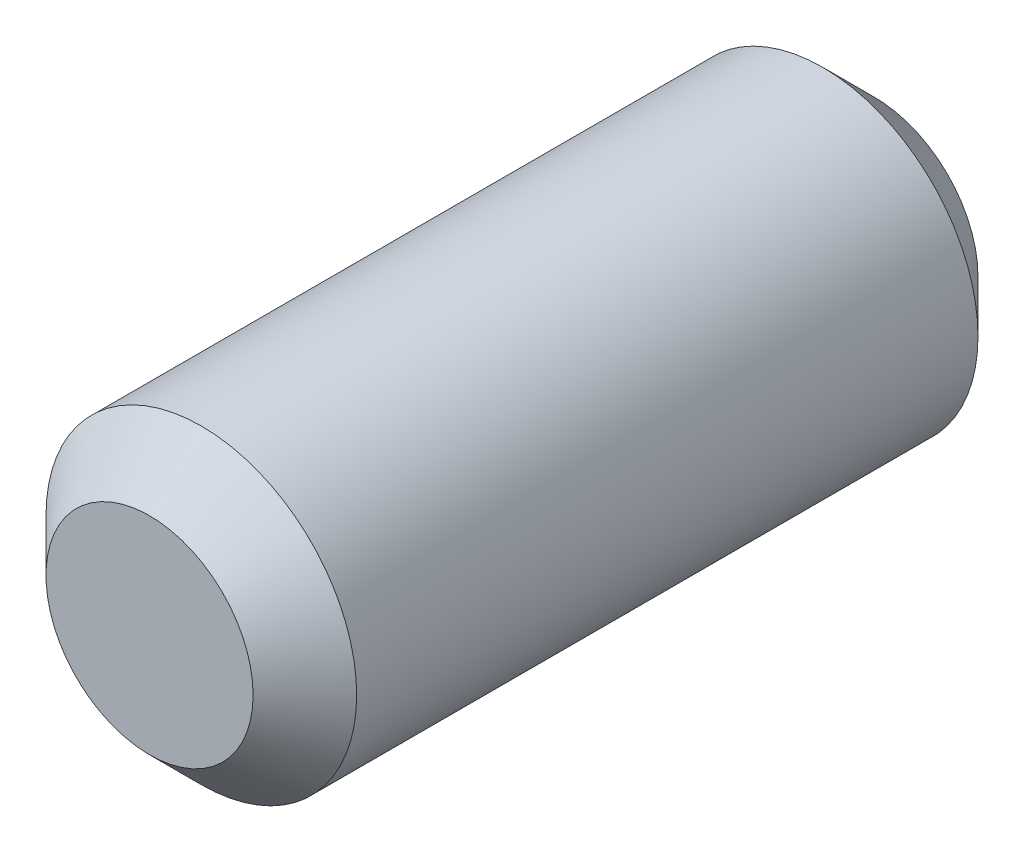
SolidWorks part; units mm, degrees
ref_plane "Plan1" through (0, 0, 0) normal (0, 0, 1) x (1, 0, 0)
ref_plane "Plan2" through (0, 0, 0) normal (0, 1, 0) x (1, 0, 0)
ref_plane "Plan3" through (0, 0, 0) normal (1, 0, 0) x (0, 0, -1)
sketch "Esquisse1" plane through (0, 0, 0) normal (0, 0, 1) x (1, 0, 0)
  circle A0 centre (0, 0) radius 1.5
  dimension "D1" = 3
extrude "Base-Extrusion" add sketch "Esquisse1" along normal blind 7
chamfer "Chanfrein1" distance 0.5 angle 45
